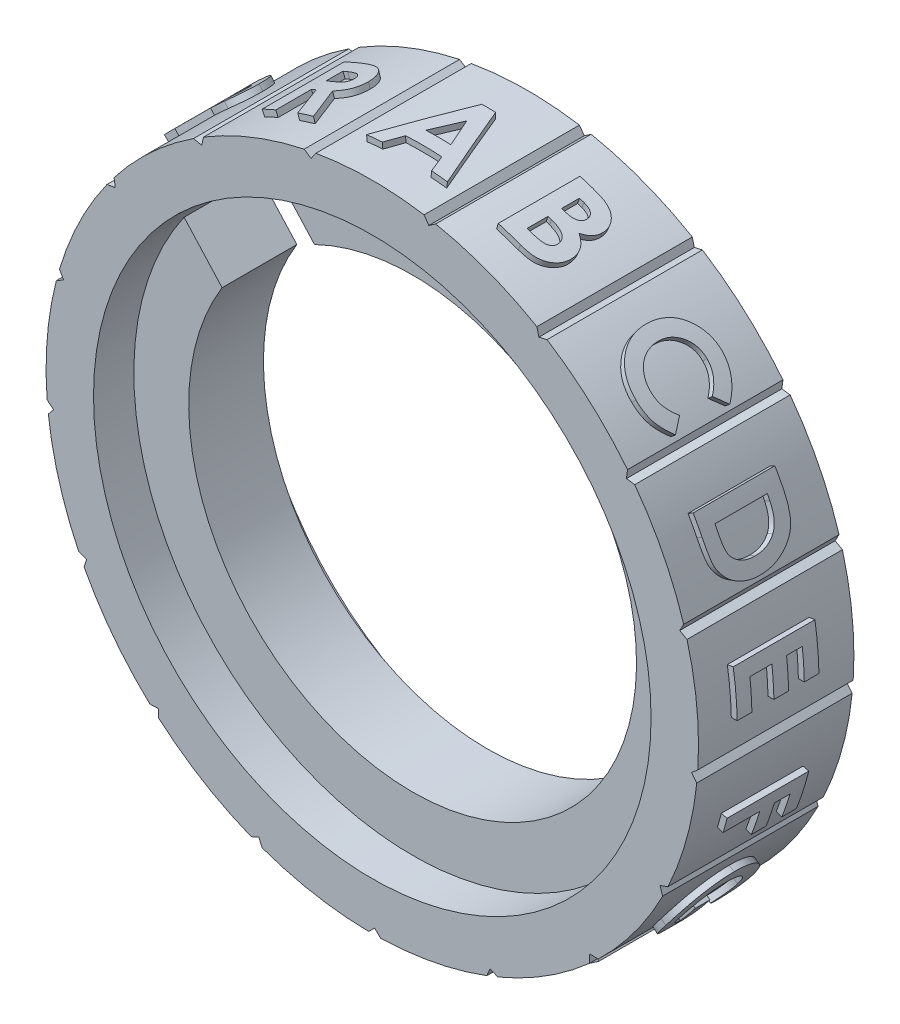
SolidWorks part; units mm, degrees
ref_plane "Front Plane" through (0, 0, 0) normal (0, 0, 1) x (1, 0, 0)
ref_plane "Top Plane" through (0, 0, 0) normal (0, 1, 0) x (1, 0, 0)
ref_plane "Right Plane" through (0, 0, 0) normal (1, 0, 0) x (0, 0, -1)
sketch "Sketch1" plane through (0, 0, 0) normal (0, 0, 1) x (1, 0, 0)
  circle A0 centre (0, 0) radius 13.97
  circle A1 centre (0, 0) radius 11.938
  dimension "D1" = 27.94
  dimension "D2" = 23.876
extrude "Boss-Extrude1" add sketch "Sketch1" along normal mid plane 6.6548
sketch "Sketch2" plane through (0, 0, 0) normal (0, 0, 1) x (1, 0, 0)
  line L0 (0, 0) -> (0, 7.4928) construction
  line L1 (-2.667, 7.4928) -> (2.667, 7.4928)
  line L3 (-2.667, 7.4928) -> (2.667, 7.4928)
  line L4 (-2.667, 7.4928) -> (-2.667, 12.4168)
  line L5 (-2.667, 12.4168) -> (2.667, 12.4168)
  line L6 (2.667, 7.4928) -> (2.667, 12.4168)
  circle A0 centre (0, 0) radius 9.5885
  circle A1 centre (0, 0) radius 12.7
  dimension "D1" = 19.177
  dimension "D4" = 25.4
  dimension "D2" = 5.334
  dimension "D3" = 4.924
extrude "Boss-Extrude2" add sketch "Sketch2" along normal mid plane 3.2004 contours L4 A1 L6 A0 | A0 L6 L5 L4 | L5 A1
sketch "Sketch3" plane through (0, 0, 0) normal (0, 1, 0) x (1, 0, 0)
  text T0 "<b>A   B    C   D   E     F   G   H    I     J     K    L   M  N   O   P    R </b>" font "Century Gothic" height 3.5
wrap "Wrap1" sketch "Sketch3" wrap type emboss source sketch "Sketch3" thickness 0.254 parameters "D1"=0.254
sketch "Sketch4" plane through (0, 0, 0) normal (0, 0, 1) x (1, 0, 0)
  line L0 (0, 0) -> (-2.667, 13.7131) construction
  line L1 (-2.667, 13.7131) -> (2.667, 13.7131) construction
  line L2 (2.667, 13.7131) -> (0, 0) construction
  line L3 (-2.6185, 13.4637) -> (-2.9159, 13.6623)
  line L4 (-2.6185, 13.4637) -> (-2.4172, 13.7593)
  circle A0 centre (0, 0) radius 13.97 construction
  circle A1 centre (0, 0) radius 13.97
  dimension "D1" = 0.508
  dimension "D2" = 0.254
extrude "Cut-Extrude1" cut sketch "Sketch4" against normal mid plane 42.2148 contours L4 A1 L3
pattern_circular "CirPattern1" count 17 over 360 about axis through (0, 0, 0) along (0, 0, 1) of "Cut-Extrude1"
sketch "Sketch5" plane through (0, 0, 0) normal (0, 0, 1) x (1, 0, 0)
  line L0 (1.9774, 1.7896) -> (-1.9774, -1.7896)
  line L1 (-1.9774, -1.7896) -> (-9.7857, 6.8379)
  line L3 (1.9774, 1.7896) -> (-5.8309, 10.4171)
  line L4 (-7.3053, 11.6086) -> (-11.0056, 8.1857)
  line L5 (-9.1555, 9.8972) -> (0, 0) construction
  circle A0 centre (0, 0) radius 11.938
  circle A1 centre (0, 0) radius 11.938 construction
  circle A2 centre (0, 0) radius 13.97 construction
  dimension "D2" = 5.334
  dimension "D1" = 5.334
  dimension "D3" = 11.6363
extrude "Cut-Extrude2" cut sketch "Sketch5" against normal mid plane 17.78
